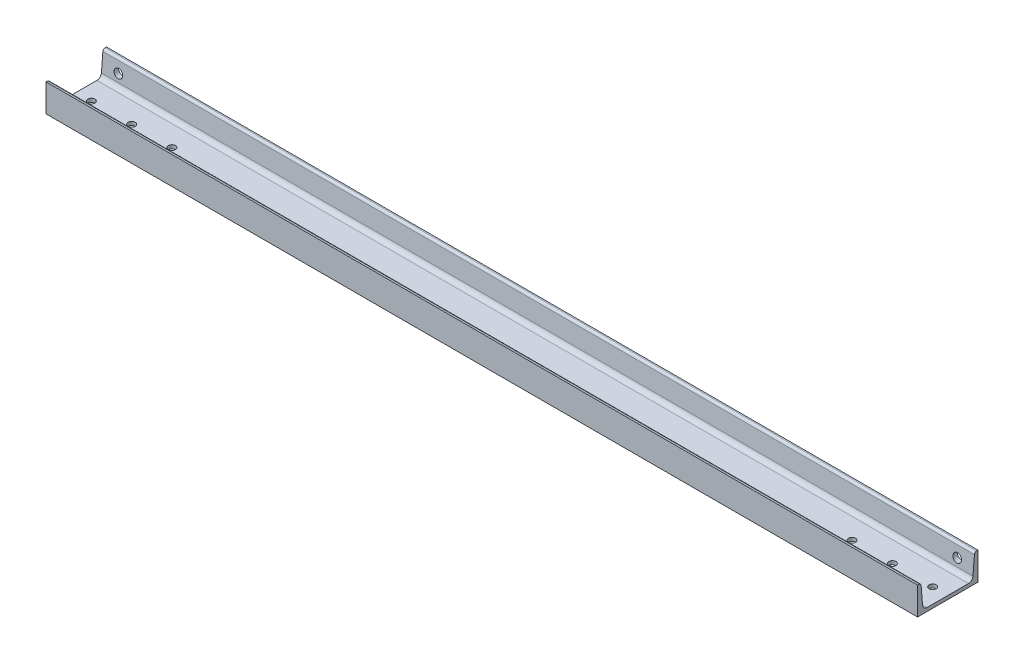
SolidWorks part; units mm, degrees
ref_plane "Plan1" through (0, 0, 0) normal (0, 0, 1) x (1, 0, 0)
ref_plane "Plan2" through (0, 0, 0) normal (0, 1, 0) x (1, 0, 0)
ref_plane "Plan3" through (0, 0, 0) normal (1, 0, 0) x (0, 0, -1)
sketch "Esquisse1" plane through (0, 0, 0) normal (1, 0, 0) x (0, 0, -1)
  line L0 (0, 0) -> (0, 55) construction
  line L1 (-60, 0) -> (60, 0)
  line L2 (60, 0) -> (60, 55)
  line L3 (60, 55) -> (57.3528, 55)
  line L4 (52.8671, 50.8585) -> (50.0235, 15.2829)
  line L5 (41.0521, 7) -> (-41.0521, 7)
  line L6 (-52.8671, 50.8585) -> (-50.0235, 15.2829)
  line L7 (-60, 55) -> (-57.3528, 55)
  line L8 (-60, 0) -> (-60, 55)
  line L10 (60, 27.5) -> (51, 27.5) construction
  arc A0 (50.0235, 15.2829) -> (41.0521, 7) centre (41.0521, 16) cw
  arc A1 (57.3528, 55) -> (52.8671, 50.8585) centre (57.3528, 50.5) ccw
  arc A2 (-57.3528, 55) -> (-52.8671, 50.8585) centre (-57.3528, 50.5) cw
  arc A3 (-50.0235, 15.2829) -> (-41.0521, 7) centre (-41.0521, 16) ccw
  point P18 (0, 7)
  dimension "R" = 9
  dimension "r1" = 4.5
  dimension "A" = 7
  dimension "D3" = 4.57
  dimension "B" = 55
  dimension "H" = 120
  dimension "A1" = 9
extrude "Base-Extrusion" add sketch "Esquisse1" along normal mid plane 1730
sketch "Esquisse2" plane through (0, 0, 0) normal (0, -1, 0) x (1, 0, 0)
  line L0 (865, 60) -> (865, -60) construction
  line L1 (865, -60) -> (-865, -60) construction
  circle A0 centre (835, 0) radius 7
  circle A1 centre (755, 0) radius 7
  circle A2 centre (675, 0) radius 7
  dimension "D4" = 14
  dimension "D5" = 14
  dimension "D6" = 14
  dimension "D8" = 60
  dimension "D1" = 30
  dimension "D2" = 80
  dimension "D3" = 80
  dimension "D7" = 60
  dimension "D9" = 60
extrude "Enlèv. mat.-Extru.1" cut sketch "Esquisse2" against normal through all
mirror "Symétrie1" about plane through (0, 0, 0) normal (1, 0, 0) of "Enlèv. mat.-Extru.1"
sketch "Esquisse3" plane through (0, 0, -60) normal (0, 0, -1) x (-1, 0, 0)
  line L0 (-865, 55) -> (865, 55) construction
  line L1 (865, 0) -> (865, 55) construction
  line L2 (-865, 0) -> (-865, 55) construction
  circle A0 centre (832.5, 30) radius 8.5
  circle A1 centre (-832.5, 30) radius 8.5
  dimension "D1" = 17
  dimension "D4" = 17
  dimension "D2" = 25
  dimension "D3" = 32.5
  dimension "D5" = 32.5
  dimension "D6" = 25
extrude "Enlèv. mat.-Extru.2" cut sketch "Esquisse3" against normal blind 10
